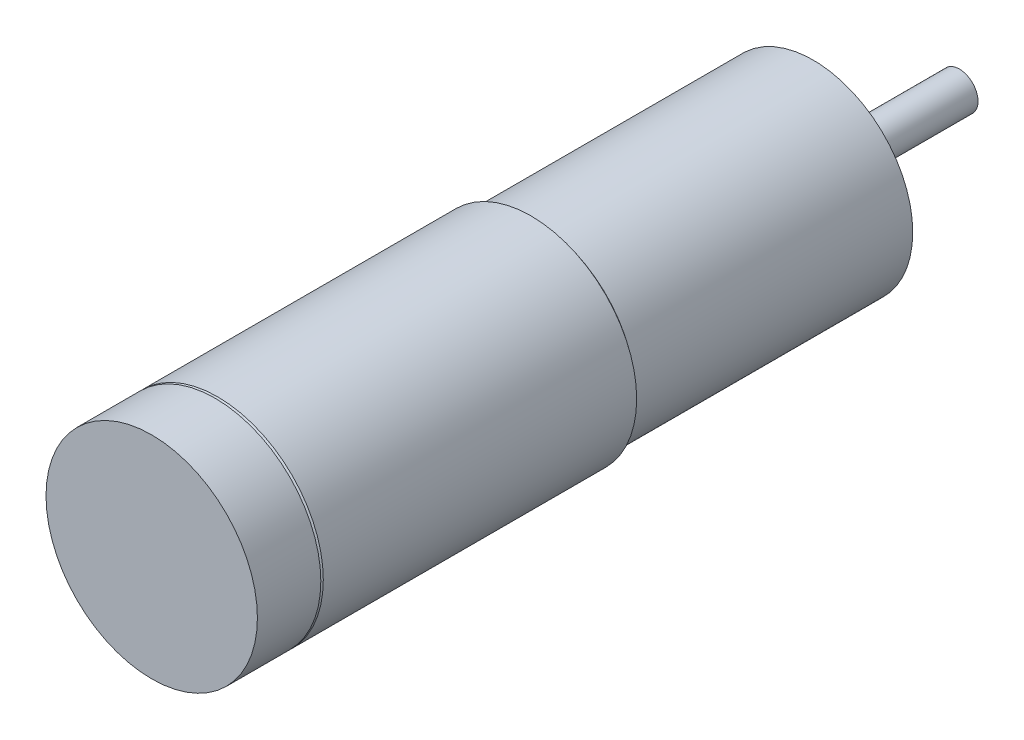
SolidWorks part; units mm, degrees
ref_plane "Front" through (0, 0, 0) normal (0, 0, 1) x (1, 0, 0)
ref_plane "Top" through (0, 0, 0) normal (0, 1, 0) x (1, 0, 0)
ref_plane "Right" through (0, 0, 0) normal (1, 0, 0) x (0, 0, -1)
sketch "Sketch1" plane through (0, 0, 0) normal (0, 0, 1) x (1, 0, 0)
  circle A0 centre (0, 0) radius 8
  dimension "D1" = 16
extrude "GP16A-110323" add sketch "Sketch1" along normal blind 22.7
chamfer "Chamfer1" distance 0.381 angle 45 1 edges at (8, 0, 22.7)
sketch "Sketch2" plane through (0, 0, 22.7) normal (0, 0, 1) x (1, 0, 0)
  circle A0 centre (0, 0) radius 8.5
  circle A2 centre (0, 0) radius 8 construction
  dimension "D1" = 17
extrude "REmax17-215992" add sketch "Sketch2" along normal blind 25.4
sketch "Sketch3" plane through (0, 0, 0) normal (0, 0, -1) x (-1, 0, 0)
  circle A0 centre (0, 0) radius 3
  circle A1 centre (0, 0) radius 8 construction
  dimension "D1" = 6
extrude "Extrude3" add sketch "Sketch3" along normal blind 2.6
sketch "Sketch5" plane through (0, 0, 0) normal (0, 0, -1) x (-1, 0, 0)
  circle A0 centre (0, 0) radius 1.5
  circle A1 centre (0, 0) radius 8 construction
  dimension "D1" = 3
extrude "Extrude4" add sketch "Sketch5" along normal blind 11.75
chamfer "Chamfer2" distance 0.2 angle 45 1 edges at (8.5, 0, 48.1)
sketch "Sketch6" plane through (0, 0, 48.1) normal (0, 0, 1) x (1, 0, 0)
  circle A0 centre (0, 0) radius 8.5
  circle A1 centre (0, 0) radius 8.5 construction
extrude "MR-201935" add sketch "Sketch6" along normal blind 5.1
hole_wizard "M2x0.4 Tapped Hole1" positions "Sketch8" profile "Sketch7" tap size "M2x0.4" standard "Ansi Metric"
sketch "Sketch8" plane through (0, 0, 0) normal (0, 0, -1) x (-1, 0, 0)
  point P0 (0, 5)
  point P1 (0, -5)
  dimension "D1" = 5
  dimension "D2" = 10
sketch "Sketch7" plane through (0, 5, 0) normal (1, 0, 0) x (0, 1, 0)
  line L0 (0, 0) -> (0, 5.6807)
  line L1 (0, 5.6807) -> (0.8, 5.2)
  line L2 (0.8, 5.2) -> (0.8, 0)
  line L5 (0.8, 0) -> (0, 0)
  line L10 (0, 5.6807) -> (-0.8, 5.2) construction
  line L11 (0, -6.35) -> (0, 107.95) construction
  dimension "Tap Drill Dia." = 1.6
  dimension "Tap Drill Depth" = 5.2
  dimension "Drill Angle" = 118
